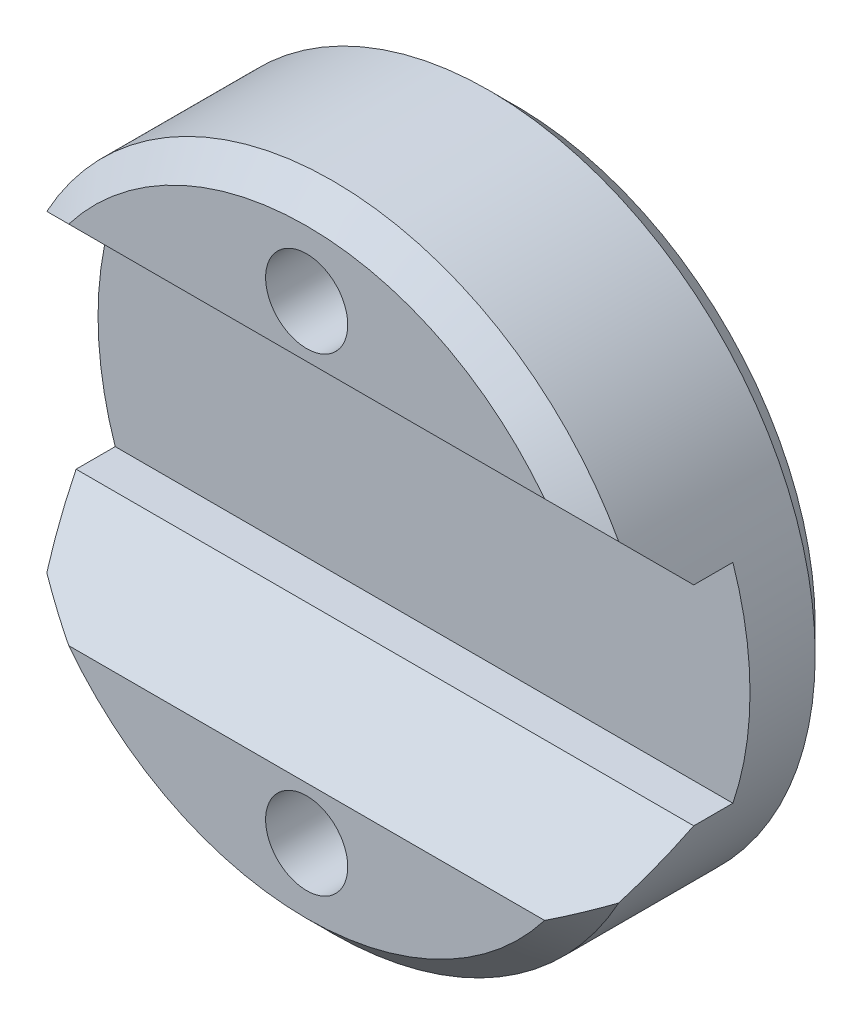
SolidWorks part; units mm, degrees
ref_plane "Plan1" through (0, 0, 0) normal (0, 0, 1) x (1, 0, 0)
ref_plane "Plan2" through (0, 0, 0) normal (0, 1, 0) x (1, 0, 0)
ref_plane "Plan3" through (0, 0, 0) normal (1, 0, 0) x (0, 0, -1)
sketch "Esquisse1" plane through (0, 0, 0) normal (0, 0, 1) x (1, 0, 0)
  circle A0 centre (0, 0) radius 25
  dimension "D1" = 50
extrude "Base-Extrusion" add sketch "Esquisse1" along normal blind 16
sketch "Esquisse6" plane through (0, 0, 16) normal (0, 0, 1) x (1, 0, 0)
  circle A0 centre (0, 18) radius 3.15
  circle A1 centre (0, -18) radius 3.15
  dimension "D3" = 6.3
  dimension "D4" = 6.3
  dimension "D1" = 18
  dimension "D2" = 18
extrude "Enlèv. mat.-Extru.6" cut sketch "Esquisse6" against normal through all
chamfer "Chanfrein1" distance 2 angle 45 1 edges at (25, 0, 0)
chamfer "Chanfrein2" distance 2 angle 45 1 edges at (25, 0, 16)
sketch "Esquisse21" plane through (0, 0, 0) normal (1, 0, 0) x (0, 0, -1)
  line L0 (-16, 23) -> (-16, -23) construction
  line L1 (-16, 8) -> (-7, 8)
  line L2 (-16, 8) -> (-16, -8)
  line L3 (-16, -8) -> (-7, -8)
  line L4 (-7, 8) -> (-7, -8)
  line L5 (-14, 0) -> (-2, 0) construction
  dimension "D1" = 8
  dimension "D2" = 8
  dimension "D3" = 9
extrude "Enlèv. mat.-Extru.8" cut sketch "Esquisse21" against normal mid plane 100
chamfer "Chanfrein5" distance 6 angle 45 6 edges at (0, 8, 16) (0, -8, 16)
